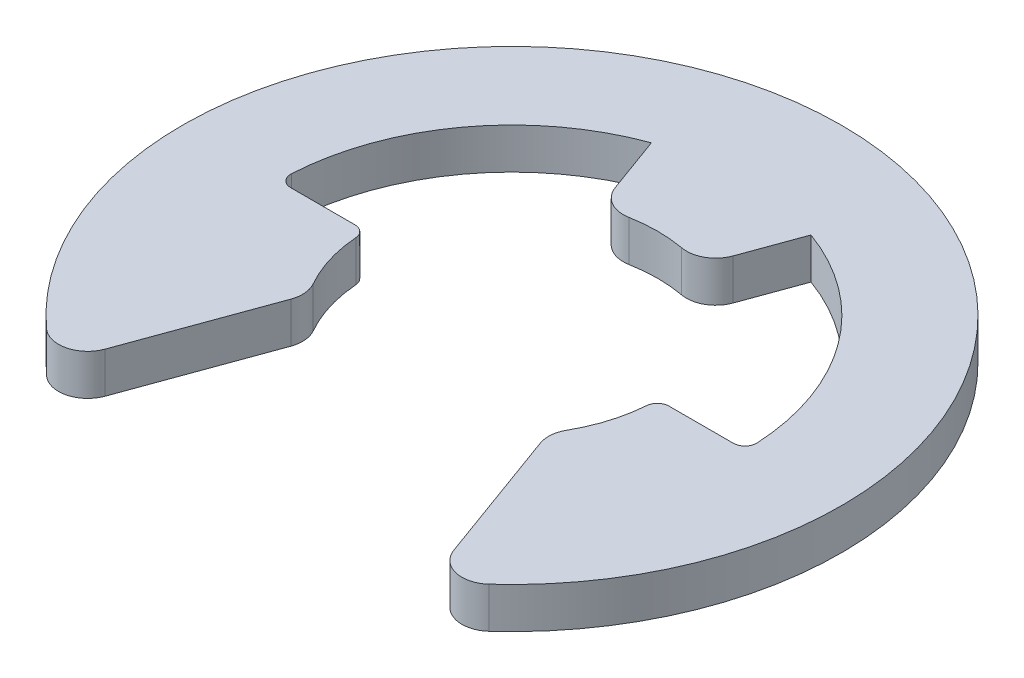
SolidWorks part; units mm, degrees
ref_plane "Front Plane" through (0, 0, 0) normal (0, 0, 1) x (1, 0, 0)
ref_plane "Top Plane" through (0, 0, 0) normal (0, 1, 0) x (1, 0, 0)
ref_plane "Right Plane" through (0, 0, 0) normal (1, 0, 0) x (0, 0, -1)
sketch "Sketch2" plane through (0, 0, 0) normal (0, 1, 0) x (1, 0, 0)
  line L0 (-3.2253, -4.639) -> (-2.055, -1.4237)
  line L2 (2.055, -1.4237) -> (3.2253, -4.639)
  line L4 (-2.5, 0) -> (-4, 0)
  line L5 (2.5, 0) -> (4, 0)
  line L6 (-1.3681, 3.7588) -> (-0.8551, 2.3492)
  line L8 (0.8551, 2.3492) -> (1.3681, 3.7588)
  arc A0 (3.2253, -4.639) -> (-3.2253, -4.639) centre (0, 0) ccw
  arc A1 (2.055, -1.4237) -> (2.5, 0) centre (0, 0) ccw
  arc A2 (4, 0) -> (1.3681, 3.7588) centre (0, 0) ccw
  arc A3 (-2.5, 0) -> (-2.055, -1.4237) centre (0, 0) ccw
  arc A4 (0.8551, 2.3492) -> (-0.8551, 2.3492) centre (0, 0) ccw
  arc A5 (-1.3681, 3.7588) -> (-4, 0) centre (0, 0) ccw
  point P15 (0, 0)
  point P16 (0, 2.5)
  dimension "D1" = 11.3
  dimension "D2" = 5
  dimension "D3" = 8
  dimension "D4" = 70
  dimension "D5" = 70
  dimension "D6" = 4.11
  dimension "D7" = 40
extrude "Boss-Extrude1" add sketch "Sketch2" along normal mid plane 0.7
fillet "Fillet1" radius 0.5 6 edges at (2.055, 0, 1.4237) (-2.055, 0, 1.4237) (0.8551, 0, -2.3492) (-0.8551, 0, -2.3492) (3.2253, 0, 4.639) (-3.2253, 0, 4.639)
fillet "Fillet2" radius 0.2 4 edges at (4, 0, 0) (2.5, 0, 0) (-4, 0, 0) (-2.5, 0, 0)
